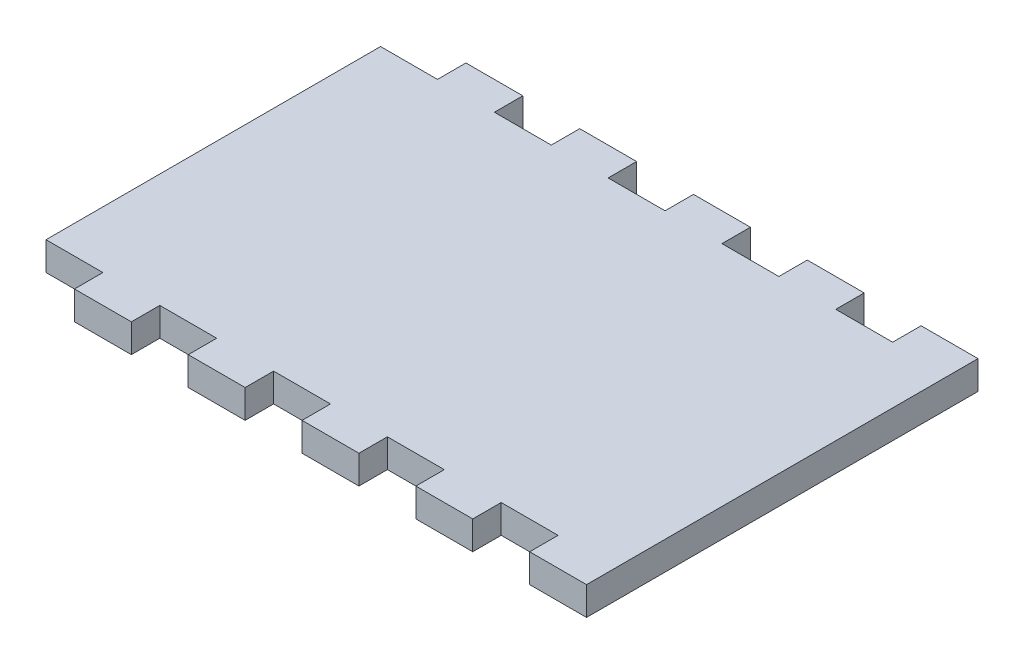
SolidWorks part; units mm, degrees
ref_plane "Front Plane" through (0, 0, 0) normal (0, 0, 1) x (1, 0, 0)
ref_plane "Top Plane" through (0, 0, 0) normal (0, 1, 0) x (1, 0, 0)
ref_plane "Right Plane" through (0, 0, 0) normal (1, 0, 0) x (0, 0, -1)
sketch "Sketch1" plane through (0, 0, 0) normal (0, 1, 0) x (1, 0, 0)
  line L1 (0, 0) -> (63.5, 0)
  line L2 (0, 0) -> (0, 43.688)
  line L3 (0, 43.688) -> (63.5, 43.688)
  line L4 (63.5, 0) -> (63.5, 43.688)
  dimension "D1" = 43.688
  dimension "D2" = 63.5
extrude "body" add sketch "Sketch1" along normal blind 3.175
sketch "Sketch4" plane through (0, 3.175, 0) normal (0, 1, 0) x (1, 0, 0)
  line L0 (0, 21.844) -> (63.5, 21.844) construction
  line L1 (63.5, 43.688) -> (0, 43.688) construction
  line L2 (0, 43.688) -> (0, 0) construction
  line L3 (0, 43.688) -> (6.35, 43.688)
  line L4 (0, 43.688) -> (0, 40.513)
  line L6 (63.5, 0) -> (63.5, 43.688) construction
  line L7 (0, 40.513) -> (6.35, 40.513)
  line L8 (6.35, 43.688) -> (6.35, 40.513)
  line L9 (6.35, 0) -> (6.35, 3.175)
  line L10 (0, 3.175) -> (6.35, 3.175)
  line L11 (0, 0) -> (0, 3.175)
  line L12 (0, 0) -> (6.35, 0)
  dimension "D1" = 0
  dimension "D2" = 6.35
  dimension "D3" = 3.175
extrude "teeth" cut sketch "Sketch4" against normal up to surface (3.175 mm away)
pattern_linear "teeth pattern" count 5 spacing 12.7 along (1, 0, 0) of "teeth"
